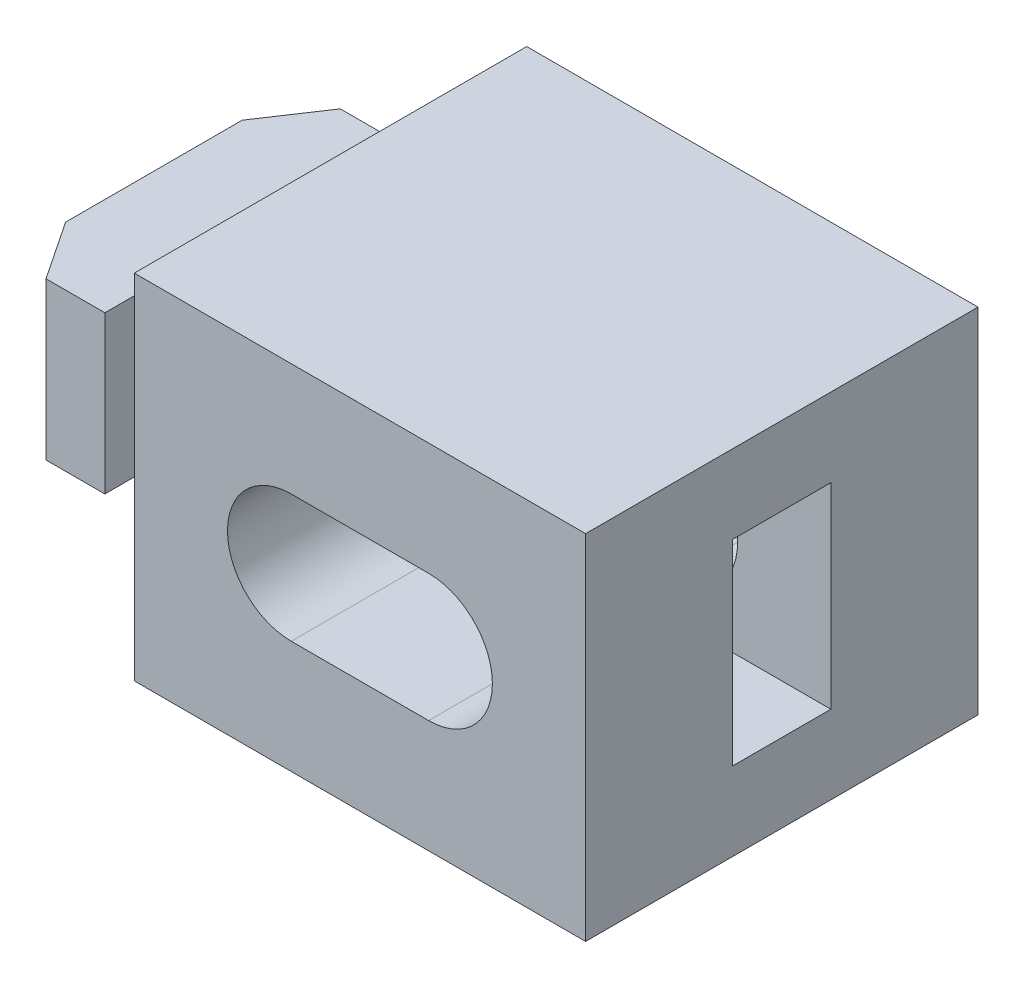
SolidWorks part; units mm, degrees
ref_plane "前视基准面" through (0, 0, 0) normal (0, 0, 1) x (1, 0, 0)
ref_plane "上视基准面" through (0, 0, 0) normal (0, 1, 0) x (1, 0, 0)
ref_plane "右视基准面" through (0, 0, 0) normal (1, 0, 0) x (0, 0, -1)
sketch "草图1" plane through (0, 0, 0) normal (0, 0, 1) x (1, 0, 0)
  line L0 (-3.5, 0) -> (3.5, 0) construction
  line L1 (-11.5, 9) -> (11.5, 9)
  line L2 (-11.5, 9) -> (-11.5, -9)
  line L3 (-11.5, -9) -> (11.5, -9)
  line L4 (11.5, 9) -> (11.5, -9)
  line L5 (-3.5, 3.25) -> (3.5, 3.25)
  line L6 (-3.5, -3.25) -> (3.5, -3.25)
  arc A0 (-3.5, 3.25) -> (-3.5, -3.25) centre (-3.5, 0) ccw
  arc A1 (3.5, -3.25) -> (3.5, 3.25) centre (3.5, 0) ccw
  point P6 (0, 0)
  dimension "D5" = 3.25
  dimension "D1" = 23
  dimension "D2" = 18
  dimension "D3" = 9
  dimension "D4" = 11.5
  dimension "D6" = 7
  dimension "D7" = 0
  dimension "D8" = 0
extrude "凸台-拉伸1" add sketch "草图1" along normal mid plane 20
sketch "草图2" plane through (11.5, 0, 0) normal (1, 0, 0) x (0, 0, -1)
  line L1 (-2.5, 5) -> (2.5, 5)
  line L2 (-2.5, 5) -> (-2.5, -5)
  line L3 (-2.5, -5) -> (2.5, -5)
  line L4 (2.5, 5) -> (2.5, -5)
  dimension "D1" = 5
  dimension "D2" = 10
  dimension "D3" = 2.5
extrude "切除-拉伸1" cut sketch "草图2" against normal blind 20
sketch "草图3" plane through (-11.5, 0, 0) normal (-1, 0, 0) x (0, 0, 1)
  line L0 (-10, 9) -> (-10, -9) construction
  line L1 (-7.5, 4) -> (7.5, 4)
  line L2 (-7.5, 4) -> (-7.5, -4)
  line L3 (-7.5, -4) -> (7.5, -4)
  line L4 (7.5, 4) -> (7.5, -4)
  dimension "D1" = 15
  dimension "D2" = 8
  dimension "D3" = 4
  dimension "D4" = 2.5
extrude "凸台-拉伸2" add sketch "草图3" along normal blind 9
sketch "草图4" plane through (0, -4, 0) normal (0, -1, 0) x (1, 0, 0)
  line L0 (-20.5, -7.5) -> (-20.5, 7.5) construction
  line L1 (-11.5, 7.5) -> (-15.5, 7.5)
  line L2 (-11.5, 7.5) -> (-11.5, 4)
  line L3 (-11.5, 4) -> (-15.5, 4)
  line L4 (-15.5, 7.5) -> (-15.5, 4)
  dimension "D1" = 3.5
  dimension "D2" = 5
extrude "切除-拉伸2" cut sketch "草图4" against normal up to next contours L3 L4 L1 L2
mirror "镜向1" about plane through (0, 0, 0) normal (0, 0, 1) of "切除-拉伸2"
fillet "圆角1" radius 3 2 edges at (-13.5, 4, 4) (-13.5, -4, -4)
sketch "草图5" plane through (0, -4, 0) normal (0, -1, 0) x (1, 0, 0)
  line L0 (-18.5, 7.5) -> (-20.5, 7.5)
  line L1 (-20.5, 7.5) -> (-15.5, 7.5) construction
  line L2 (-20.5, 7.5) -> (-20.5, 4.5)
  line L3 (-20.5, -7.5) -> (-20.5, 7.5) construction
  line L4 (-20.5, 4.5) -> (-18.5, 7.5)
  dimension "D1" = 2
  dimension "D2" = 3
extrude "切除-拉伸3" cut sketch "草图5" against normal blind 9
mirror "镜向2" about plane through (0, 0, 0) normal (0, 0, 1) of "切除-拉伸3"
